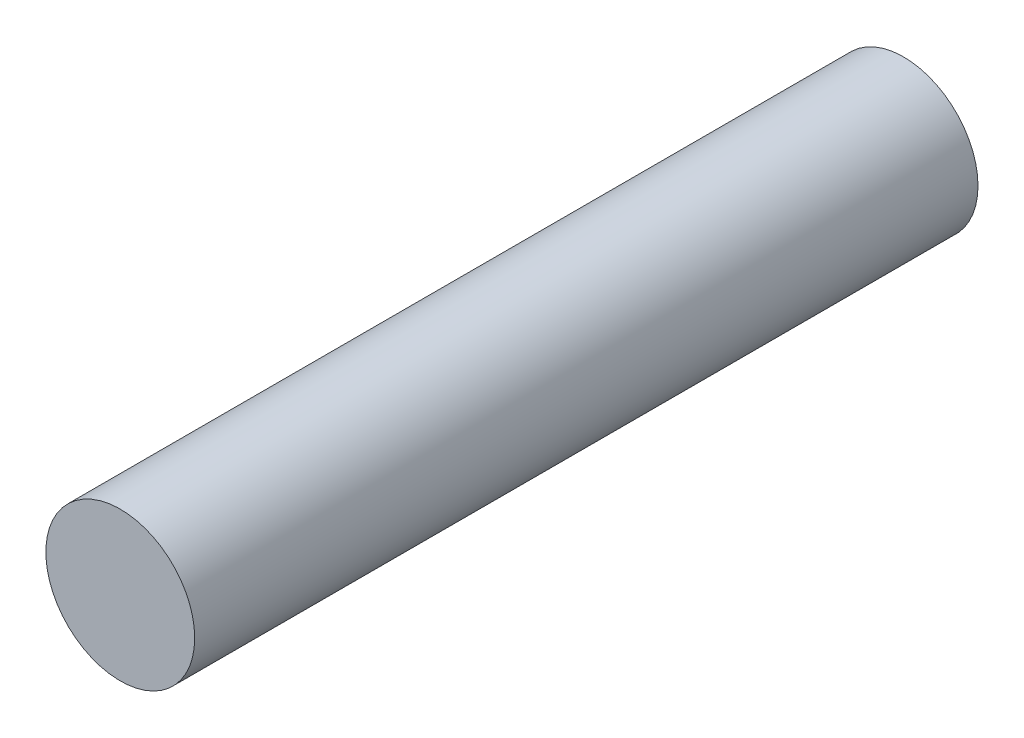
SolidWorks part; units mm, degrees
ref_plane "Plan de face" through (0, 0, 0) normal (0, 0, 1) x (1, 0, 0)
ref_plane "Plan de dessus" through (0, 0, 0) normal (0, 1, 0) x (1, 0, 0)
ref_plane "Plan de droite" through (0, 0, 0) normal (1, 0, 0) x (0, 0, -1)
sketch "Esquisse1" plane through (0, 0, 0) normal (0, 0, 1) x (1, 0, 0)
  circle A0 centre (0, 0) radius 0.95
  dimension "D1" = 1.9
extrude "Extrusion1" add sketch "Esquisse1" along normal blind 10
